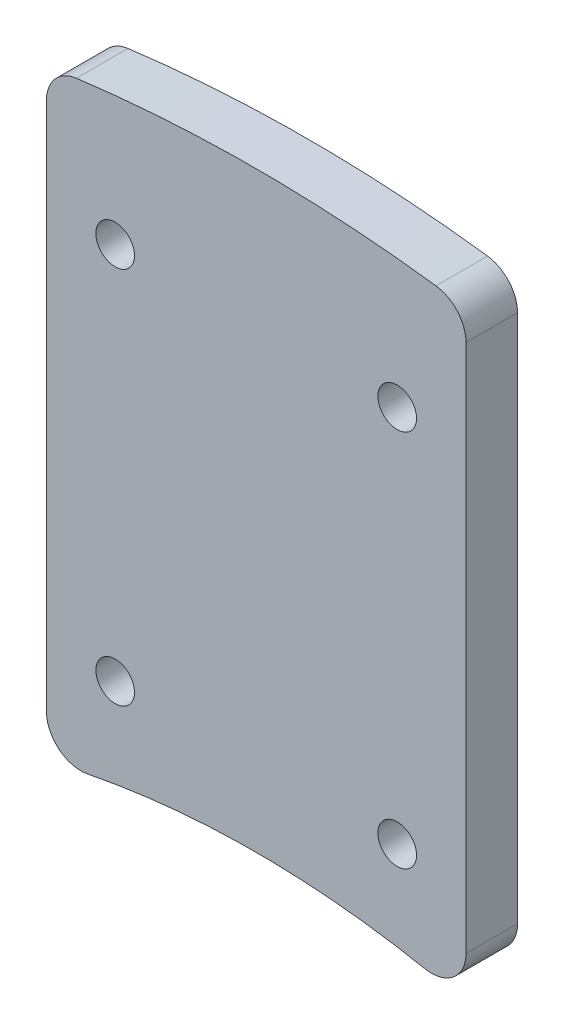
SolidWorks part; units mm, degrees
ref_plane "Front" through (0, 0, 0) normal (0, 0, 1) x (1, 0, 0)
ref_plane "Top" through (0, 0, 0) normal (0, 1, 0) x (1, 0, 0)
ref_plane "Right" through (0, 0, 0) normal (1, 0, 0) x (0, 0, -1)
sketch "Sketch1" plane through (0, 0, 0) normal (0, 0, 1) x (1, 0, 0)
  line L1 (0, 0) -> (77.47, 0)
  line L2 (0, 0) -> (0, 139.7)
  line L3 (0, 139.7) -> (77.47, 139.7)
  line L4 (77.47, 0) -> (77.47, 139.7)
  dimension "D1" = 139.7
  dimension "D2" = 77.47
extrude "Extrude1" add sketch "Sketch1" along normal blind 9.525
fillet "Fillet2" radius 3.175 2 edges at (77.47, 139.7, 4.7625) (0, 139.7, 4.7625)
sketch "Sketch5" plane through (0, 0, 9.525) normal (0, 0, 1) x (1, 0, 0)
  line L0 (12.7, 31.75) -> (12.7, 101.6) construction
  line L1 (64.77, 31.75) -> (64.77, 118.3081) construction
  line L2 (12.7, 101.6) -> (83.1429, 101.6) construction
  line L3 (12.7, 31.75) -> (86.0769, 31.75) construction
  line L4 (0, 136.525) -> (0, 0) construction
  line L5 (74.295, 139.7) -> (3.175, 139.7) construction
  line L7 (0, 0) -> (77.47, 0) construction
  line L8 (38.735, 0) -> (38.735, 7.8529) construction
  circle A1 centre (12.7, 101.6) radius 3.5687
  circle A2 centre (64.77, 31.75) radius 3.5687
  circle A4 centre (64.77, 101.6) radius 3.5687
  circle A5 centre (12.7, 31.75) radius 3.5687
  dimension "D1" = 31.75
  dimension "D2" = 12.7
  dimension "D3" = 38.1
extrude "Cut-Extrude1" cut sketch "Sketch5" against normal through all
sketch "Sketch6" plane through (0, 0, 9.525) normal (0, 0, 1) x (1, 0, 0)
  line L4 (77.47, 144.5431) -> (0, 144.5431)
  line L6 (0, 144.5431) -> (0, 123.825)
  line L7 (77.47, 144.5431) -> (77.47, 124.0844)
  arc A1 (77.47, 123.825) -> (0, 123.825) centre (38.735, -132.0219) ccw
sketch "Sketch7" plane through (0, 0, 9.525) normal (0, 0, 1) x (1, 0, 0)
  line L0 (38.735, 0) -> (38.735, -51.5296) construction
  line L1 (0, 0) -> (77.47, 0) construction
  line L2 (38.735, 0) -> (38.735, 44.7348) construction
  line L3 (0, -14.5829) -> (77.47, -14.5829)
  line L4 (0, 0) -> (0, 12.7)
  line L5 (77.47, 0) -> (77.47, -14.5829)
  line L6 (0, 0) -> (0, -14.5829)
  line L7 (77.47, 0) -> (77.47, 12.7)
  arc A1 (77.47, 12.7) -> (0, 12.7) centre (38.735, -143.8697) ccw
extrude "Cut-Extrude3" cut sketch "Sketch7" against normal through all
hole_wizard "CSK for 1/4 Flat Head Machine Screw (100)1" positions "Sketch12" profile "Sketch11" countersink size "1/4" standard "Ansi Inch"
sketch "Sketch12" plane through (0, 0, 9.525) normal (0, 0, 1) x (1, 0, 0)
  point P0 (12.7, 101.6)
  point P3 (64.77, 101.6)
  point P5 (64.77, 31.75)
  point P7 (12.7, 31.75)
sketch "Sketch11" plane through (12.7, 101.6, 9.525) normal (1, 0, 0) x (0, -1, 0)
  line L0 (0, 0) -> (0, 27.4298)
  line L1 (0, 27.4298) -> (3.3782, 25.4)
  line L2 (3.3782, 25.4) -> (3.3782, 2.5682)
  line L3 (3.3782, 2.5682) -> (6.4389, 0)
  line L5 (6.4389, 0) -> (0, 0)
  line L6 (-3.3782, 2.5682) -> (-6.4389, 0) construction
  line L10 (0, 27.4298) -> (-3.3782, 25.4) construction
  line L11 (0, -6.35) -> (0, 107.95) construction
  dimension "Hole Dia." = 6.7564
  dimension "Hole Depth" = 25.4
  dimension "Near C'Sink Dia." = 12.8778
  dimension "Near C'Sink Angle" = 100
  dimension "Drill Angle" = 118
extrude "Cut-Extrude4" cut sketch "Sketch6" against normal through all flip side to cut
fillet "Fillet3" radius 6.35 4 edges at (77.47, 123.825, 4.7625) (0, 123.825, 4.7625) (77.47, 12.7, 4.7625) (0, 12.7, 4.7625)
sketch "Sketch13" [suppressed] plane through (0, 0, 0) normal (0, 0, -1) x (-1, 0, 0)
  line L1 (-93.8771, 136.5957) -> (9.5303, 136.5957)
  line L2 (-93.8771, 136.5957) -> (-93.8771, -2.9788)
  line L3 (-93.8771, -2.9788) -> (9.5303, -2.9788)
  line L4 (9.5303, 136.5957) -> (9.5303, -2.9788)
extrude "Cut-Extrude5" [suppressed] cut sketch "Sketch13" against normal blind 3.175
